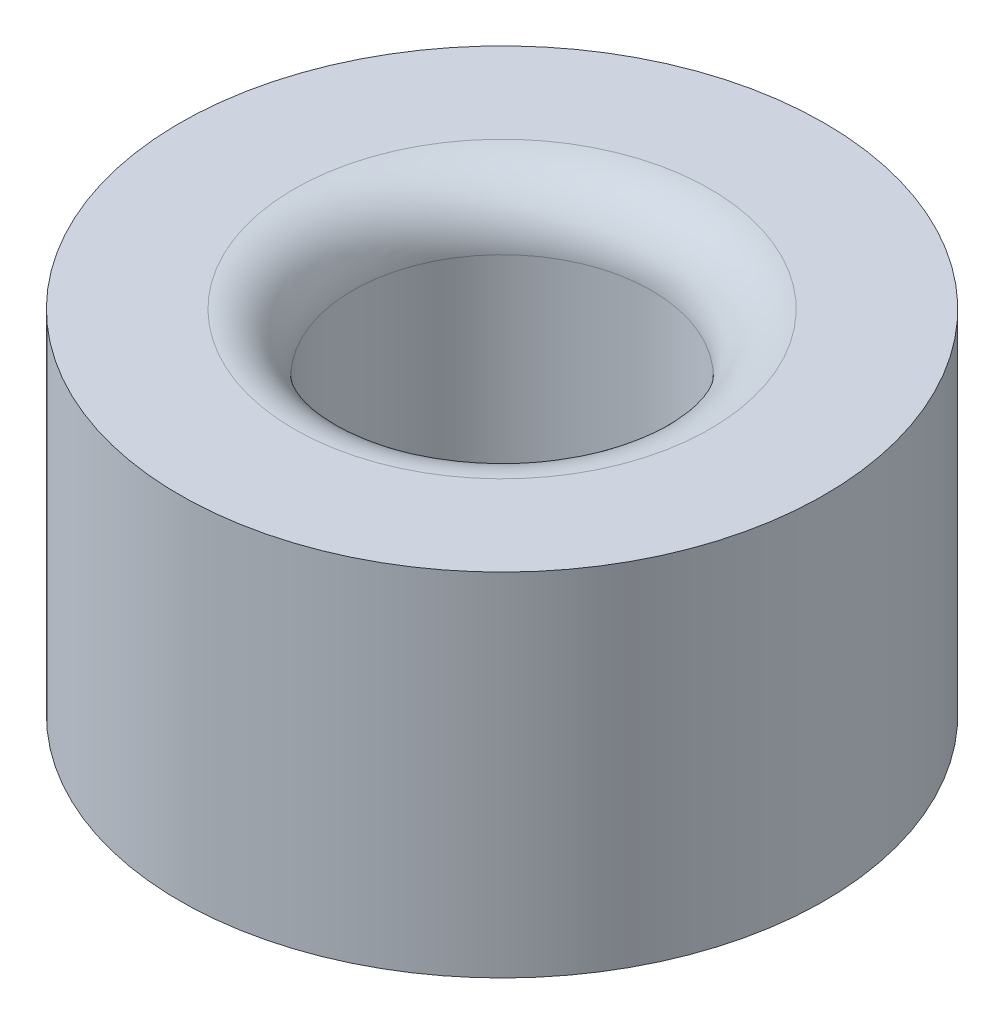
SolidWorks part; units mm, degrees
ref_plane "Front Plane" through (0, 0, 0) normal (0, 0, 1) x (1, 0, 0)
ref_plane "Top Plane" through (0, 0, 0) normal (0, 1, 0) x (1, 0, 0)
ref_plane "Right Plane" through (0, 0, 0) normal (1, 0, 0) x (0, 0, -1)
sketch "Sketch1" plane through (0, 0, 0) normal (0, 1, 0) x (1, 0, 0)
  circle A0 centre (0, 0) radius 13.97
  circle A1 centre (0, 0) radius 6.477
  dimension "D1" = 12.954
  dimension "D2" = 27.94
extrude "Boss-Extrude1" add sketch "Sketch1" along normal blind 15.24
fillet "Fillet1" radius 2.54 2 edges at (0, 0, 6.477) (0, 15.24, 6.477)
